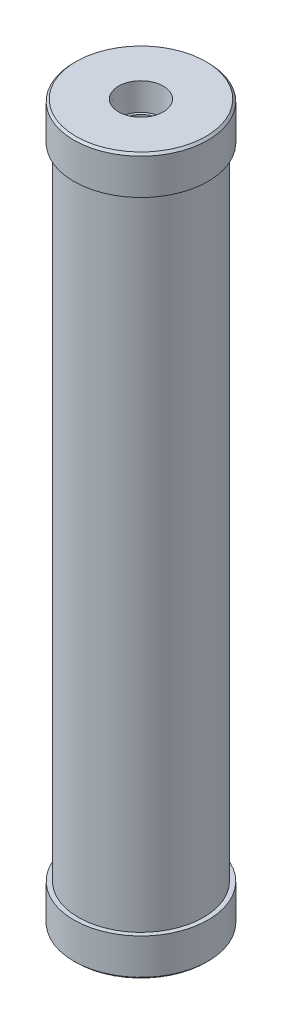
SolidWorks part; units mm, degrees
ref_plane "Front Plane" through (0, 0, 0) normal (0, 0, 1) x (1, 0, 0)
ref_plane "Top Plane" through (0, 0, 0) normal (0, 1, 0) x (1, 0, 0)
ref_plane "Right Plane" through (0, 0, 0) normal (1, 0, 0) x (0, 0, -1)
sketch "Sketch1" plane through (0, 0, 0) normal (0, 1, 0) x (1, 0, 0)
  circle A0 centre (0, 0) radius 44.45
  circle A1 centre (0, 0) radius 38.6334
  dimension "D1" = 88.9
  dimension "D2" = 5.8166
extrude "Boss-Extrude1" add sketch "Sketch1" along normal blind 508
ref_plane "Plane1" through (0, 508, 0) normal (0, 1, 0) x (1, 0, 0)
sketch "Sketch2" plane through (0, 0, 0) normal (0, 1, 0) x (1, 0, 0)
  circle A0 centre (0, 0) radius 47.625
  dimension "D1" = 95.25
extrude "Boss-Extrude2" add sketch "Sketch2" along normal blind 26.924
hole_wizard "1 Rc Tapped Hole1" positions "Sketch4" profile "Sketch3" size "1" standard "BSI"
sketch "Sketch4" plane through (0, 0, 0) normal (0, 1, 0) x (1, 0, 0)
  point P0 (0, 0)
sketch "Sketch3" plane through (0, 0, 0) normal (1, 0, 0) x (0, 0, -1)
  line L0 (0, 0) -> (0, 38.5916)
  line L1 (13.5, 30.48) -> (0, 38.5916)
  line L2 (-13.5, 30.48) -> (0, 38.5916) construction
  line L3 (13.5, 30.48) -> (13.5, 19.05)
  line L4 (13.5, 19.05) -> (15.2919, 19.05)
  line L5 (15.2919, 19.05) -> (15.8866, 0)
  line L6 (-15.2919, 19.05) -> (-15.8866, 0) construction
  line L7 (15.8866, 0) -> (0, 0)
  line L8 (0, -6.35) -> (0, 107.95) construction
  line L11 (-13.5, 19.05) -> (-15.2919, 19.05) construction
  dimension "Tap Drill Dia." = 27
  dimension "Tap Drill Depth" = 30.48
  dimension "Thread Dia." = 31.7731
  dimension "Thread Angle" = 3.576
  dimension "Thread Depth" = 19.05
  dimension "Drill Angle" = 118
sketch "Sketch5" plane through (0, 508, 0) normal (0, 1, 0) x (1, 0, 0)
  circle A0 centre (0, 0) radius 47.625
  dimension "D1" = 95.25
extrude "Boss-Extrude3" add sketch "Sketch5" against normal blind 26.924
hole_wizard "1 Rc Tapped Hole2" positions "Sketch7" profile "Sketch6" size "1" standard "BSI"
sketch "Sketch7" plane through (0, 508, 0) normal (0, 1, 0) x (1, 0, 0)
  point P0 (0, 0)
sketch "Sketch6" plane through (0, 508, 0) normal (1, 0, 0) x (0, 0, 1)
  line L0 (0, 0) -> (0, 38.5916)
  line L1 (13.5, 30.48) -> (0, 38.5916)
  line L2 (-13.5, 30.48) -> (0, 38.5916) construction
  line L3 (13.5, 30.48) -> (13.5, 19.05)
  line L4 (13.5, 19.05) -> (15.2919, 19.05)
  line L5 (15.2919, 19.05) -> (15.8866, 0)
  line L6 (-15.2919, 19.05) -> (-15.8866, 0) construction
  line L7 (15.8866, 0) -> (0, 0)
  line L8 (0, -6.35) -> (0, 107.95) construction
  line L11 (-13.5, 19.05) -> (-15.2919, 19.05) construction
  dimension "Tap Drill Dia." = 27
  dimension "Tap Drill Depth" = 30.48
  dimension "Thread Dia." = 31.7731
  dimension "Thread Angle" = 3.576
  dimension "Thread Depth" = 19.05
  dimension "Drill Angle" = 118
chamfer "Chamfer1" distance 1.524 angle 45 2 edges at (0, 0, 47.625) (0, 508, 47.625)
